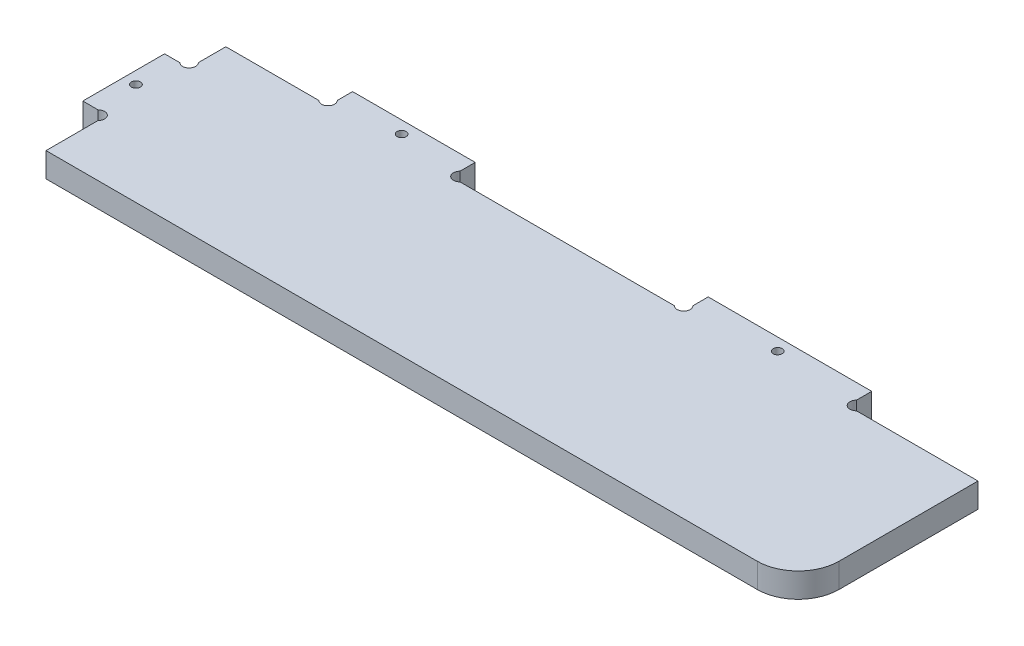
SolidWorks part; units mm, degrees
ref_plane "Plan de face" through (0, 0, 0) normal (0, 0, 1) x (1, 0, 0)
ref_plane "Plan de dessus" through (0, 0, 0) normal (0, 1, 0) x (1, 0, 0)
ref_plane "Plan de droite" through (0, 0, 0) normal (1, 0, 0) x (0, 0, -1)
sketch "Esquisse1" plane through (0, 0, 0) normal (0, 1, 0) x (1, 0, 0)
  line L0 (0, -17.0026) -> (0, 193.7463) construction
  line L1 (-65.4634, 0) -> (262.3041, 0) construction
  line L2 (-65.4634, 50) -> (262.3041, 50) construction
  line L3 (190, 193.7463) -> (190, -17.0026) construction
  line L4 (-45.61, 25) -> (128.9496, 25) construction
  line L5 (6, -17.0026) -> (6, 178.5107) construction
  line L6 (95, 131.8413) -> (95, 70.7829) construction
  line L7 (31, 178.5107) -> (31, 142.4654) construction
  line L8 (89.5, 165.8763) -> (89.5, 142.4654) construction
  line L9 (61, 178.5107) -> (61, 142.4654) construction
  line L10 (118, 178.5107) -> (118, 142.4654) construction
  line L11 (158, 178.5107) -> (158, 142.4654) construction
  line L12 (41.3743, 47) -> (176.866, 47) construction
  line L13 (262.3041, 44) -> (-6.1418, 44) construction
  line L14 (46, 165.8763) -> (46, 142.4654) construction
  line L15 (138, 165.8763) -> (138, 142.4654) construction
  line L16 (31, 44) -> (18.5232, 56.4768) construction
  line L17 (-29.5814, 35) -> (10.6276, 35) construction
  line L18 (6, 35) -> (-14.0398, 55.0398) construction
  line L19 (3.7373, 35) -> (0, 35)
  line L20 (3.7373, 15) -> (0, 15)
  line L21 (0, 35) -> (0, 15)
  line L22 (6, 37.2627) -> (6, 44)
  line L23 (6, 44) -> (28.7373, 44)
  line L24 (31, 46.2627) -> (31, 50)
  line L25 (31, 50) -> (61, 50)
  line L26 (61, 50) -> (61, 46.2627)
  line L27 (63.2627, 44) -> (115.7373, 44)
  line L28 (118, 46.2627) -> (118, 50)
  line L29 (118, 50) -> (158, 50)
  line L30 (158, 50) -> (158, 46.2627)
  line L31 (160.2627, 44) -> (190, 44)
  line L32 (6, 0) -> (180, 0)
  line L33 (190, 10) -> (190, 44)
  line L34 (46, 58.37) -> (46, 42.148) construction
  line L35 (138, 58.37) -> (138, 42.148) construction
  line L41 (6, 12.7373) -> (6, 0)
  line L47 (3, 83.5846) -> (3, 18.9594) construction
  arc A0 (28.7373, 44) -> (31, 46.2627) centre (29.8686, 45.1314) ccw
  arc A1 (63.2627, 44) -> (61, 46.2627) centre (62.1314, 45.1314) cw
  arc A2 (115.7373, 44) -> (118, 46.2627) centre (116.8686, 45.1314) ccw
  arc A3 (160.2627, 44) -> (158, 46.2627) centre (159.1314, 45.1314) cw
  arc A4 (3.7373, 35) -> (6, 37.2627) centre (4.8686, 36.1314) ccw
  arc A5 (3.7373, 15) -> (6, 12.7373) centre (4.8686, 13.8686) cw
  arc A6 (180, 0) -> (190, 10) centre (180, 10) ccw
  circle A7 centre (3, 25) radius 1.1
  circle A8 centre (46, 47) radius 1.1
  circle A9 centre (138, 47) radius 1.1
  point P68 (190, 0)
  dimension "D16" = 10
  dimension "D18" = 3
  dimension "D19" = 10
  dimension "D1" = 50
  dimension "D2" = 25
  dimension "D3" = 190
  dimension "D4" = 95
  dimension "D5" = 6
  dimension "D6" = 30
  dimension "D7" = 3
  dimension "D8" = 40
  dimension "D9" = 57
  dimension "D10" = 25
  dimension "D11" = 6
  dimension "D12" = 15
  dimension "D13" = 28.5
  dimension "D14" = 20
  dimension "D15" = 45
  dimension "D17" = 45
extrude "Boss.-Extru.1" add sketch "Esquisse1" along normal blind 6
